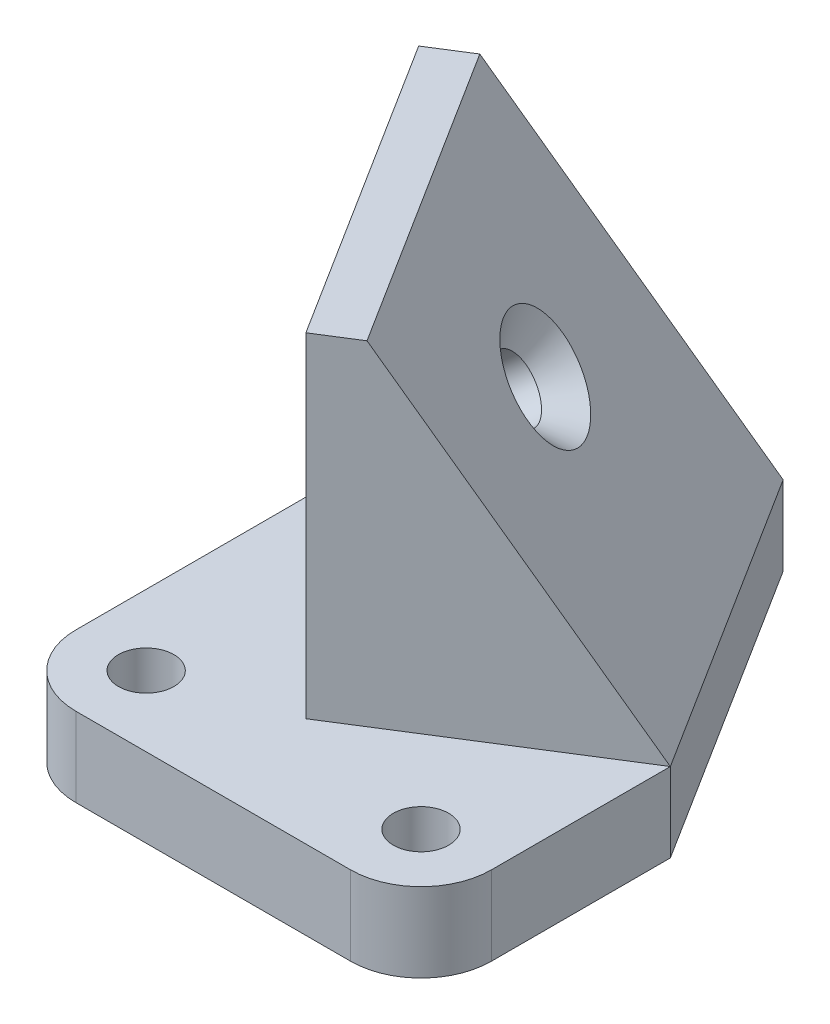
SolidWorks part; units mm, degrees
ref_plane "Front" through (0, 0, 0) normal (0, 0, 1) x (1, 0, 0)
ref_plane "Top" through (0, 0, 0) normal (0, 1, 0) x (1, 0, 0)
ref_plane "Right" through (0, 0, 0) normal (1, 0, 0) x (0, 0, -1)
sketch "Sketch1" plane through (0, 0, 0) normal (0, 1, 0) x (1, 0, 0)
  line L0 (0, 0) -> (0, 45)
  line L1 (0, 45) -> (-34.641, 100)
  line L2 (0, 0) -> (-75, 0)
  line L3 (-75, 0) -> (-75, 74.5804)
  line L4 (-34.641, 100) -> (-75, 74.5804)
  dimension "D1" = 75
  dimension "D2" = 45
  dimension "D3" = 32.204
  dimension "D4" = 65
  dimension "D5" = 100
extrude "Base-Extrude" add sketch "Sketch1" along normal blind 14.2875
sketch "Sketch2" plane through (0, 14.2875, 0) normal (0, 1, 0) x (-1, 0, 0)
  line L0 (34.641, -100) -> (75, -74.5804)
  line L1 (75, -74.5804) -> (40.359, -19.5804)
  line L2 (34.641, -100) -> (0, -45)
  line L3 (0, -45) -> (40.359, -19.5804)
extrude "Boss-Extrude1" add sketch "Sketch2" along normal blind 60.325
sketch "Sketch3" plane through (-20.2927, 0, -32.2189) normal (0.5329, 0, 0.8462) x (0.8462, 0, -0.5329)
  line L0 (-15.7147, 74.6125) -> (23.9822, 14.2875)
  line L1 (23.9822, 74.6125) -> (-23.7147, 74.6125) construction
  line L2 (-23.7147, 74.6125) -> (-23.7147, 14.2875) construction
  line L4 (23.9822, 74.6125) -> (23.9822, 14.2875) construction
  dimension "D1" = 8
  dimension "D2" = 33.347
extrude "Cut-Extrude1" cut sketch "Sketch3" against normal through all
hole_wizard "CSK for M10 Flat Head Machine Screw1" positions "Sketch6" profile "Sketch5" countersink size "M10" standard "Ansi Metric"
sketch "Sketch6" plane through (19.7121, 15.3301, -12.4154) normal (0.7068, 0.5497, -0.4452) x (-0.3678, -0.252, -0.8951)
  line L0 (98.6509, 29.9065) -> (76.8651, 98.7566) construction
  line L1 (14.8935, 79.1473) -> (76.8651, 98.7566) construction
  point P0 (53.6091, 60.4335)
  dimension "D1" = 33.7338
  dimension "D2" = 29.5216
sketch "Sketch5" plane through (-36.5211, 49.9514, -58.9486) normal (-0.104, 0.7033, 0.7033) x (-0.6997, 0.4508, -0.5543)
  line L0 (0, 0) -> (0, 28.7047)
  line L1 (0, 28.7047) -> (5.5, 25.4)
  line L2 (5.5, 25.4) -> (5.5, 4.5)
  line L3 (5.5, 4.5) -> (10, 0)
  line L5 (10, 0) -> (0, 0)
  line L6 (-5.5, 4.5) -> (-10, 0) construction
  line L10 (0, 28.7047) -> (-5.5, 25.4) construction
  line L11 (0, -6.35) -> (0, 107.95) construction
  dimension "Hole Dia." = 11
  dimension "Hole Depth" = 25.4
  dimension "Near C'Sink Dia." = 20
  dimension "Near C'Sink Angle" = 90
  dimension "Drill Angle" = 118
fillet "Fillet1" radius 12.7 2 edges at (0, 7.1437, 0) (-75, 7.1437, 0)
hole_wizard "Ø10.0 (10) Diameter Hole1" positions "Sketch9" profile "Sketch8" hole size "Ø10.0" standard "Ansi Metric"
sketch "Sketch9" plane through (0, 14.2875, 0) normal (0, 1, 0) x (-1, 0, 0)
  line L0 (0, -12.7) -> (0, -45) construction
  arc A0 (75, -12.7) -> (62.3, 0) centre (62.3, -12.7) ccw construction
  point P0 (12.7, -12.7)
  point P1 (62.3, -12.7)
sketch "Sketch8" plane through (-12.7, 14.2875, -12.7) normal (1, 0, 0) x (0, 0, 1)
  line L0 (0, 0) -> (0, 14.2875)
  line L1 (0, 14.2875) -> (5, 14.2875)
  line L2 (5, 14.2875) -> (5, 0)
  line L5 (5, 0) -> (0, 0)
  line L11 (0, -6.35) -> (0, 28.9116) construction
  dimension "Thru Hole Dia." = 10
  dimension "Thru Hole Depth" = 14.2875
